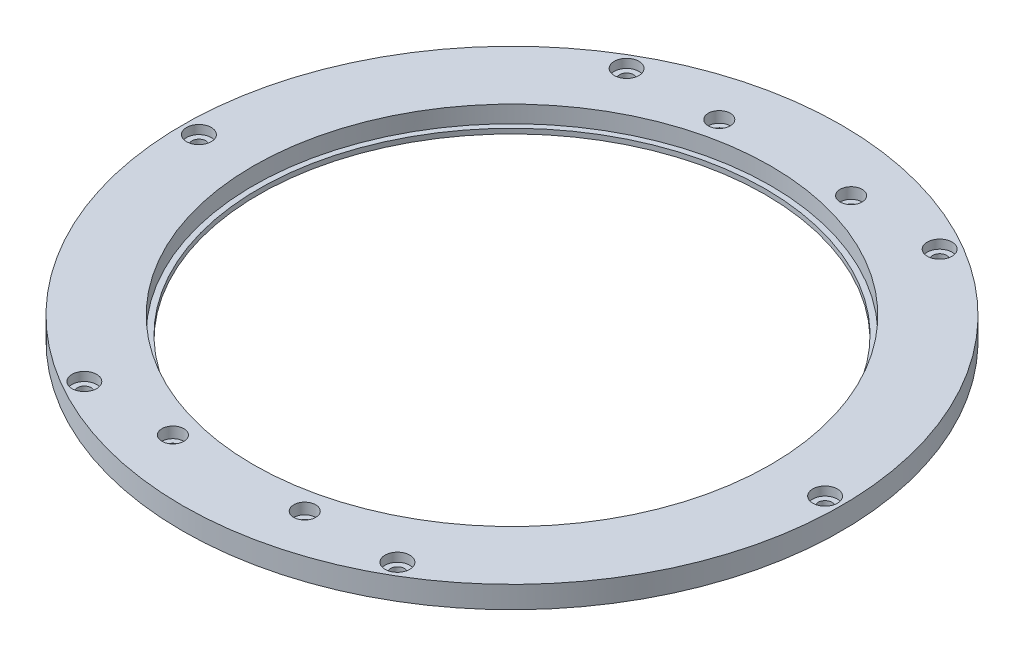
SolidWorks part; units mm, degrees
ref_plane "前视基准面" through (0, 0, 0) normal (0, 0, 1) x (1, 0, 0)
ref_plane "上视基准面" through (0, 0, 0) normal (0, 1, 0) x (1, 0, 0)
ref_plane "右视基准面" through (0, 0, 0) normal (1, 0, 0) x (0, 0, -1)
sketch "草图1" plane through (0, 0, 0) normal (0, 1, 0) x (1, 0, 0)
  circle A0 centre (0, 0) radius 47.1
  circle A1 centre (0, 0) radius 60
  dimension "D1" = 94.2
  dimension "D2" = 120
extrude "凸台-拉伸1" add sketch "草图1" along normal blind 4
sketch "草图2" plane through (0, 0, 0) normal (0, -1, 0) x (1, 0, 0)
  circle A0 centre (0, 0) radius 46.1
  circle A2 centre (0, 0) radius 47.1 construction
  circle A3 centre (0, 0) radius 47.1
  dimension "D1" = 1
extrude "凸台-拉伸2" add sketch "草图2" against normal blind 0.9
sketch "草图3" plane through (0, 0, 0) normal (0, -1, 0) x (1, 0, 0)
  circle A0 centre (-28.5, 49.3634) radius 1.25
  circle A1 centre (-57, 0) radius 1.25
  circle A2 centre (-28.5, -49.3634) radius 1.25
  circle A3 centre (28.5, -49.3634) radius 1.25
  circle A4 centre (57, 0) radius 1.25
  circle A6 centre (28.5, 49.3634) radius 1.25
extrude "切除-拉伸1" cut sketch "草图3" against normal through all
sketch "草图4" plane through (0, 4, 0) normal (0, 1, 0) x (1, 0, 0)
  circle A0 centre (-28.5, 49.3634) radius 2.25
  circle A1 centre (28.5, 49.3634) radius 2.25
  circle A2 centre (57, 0) radius 2.25
  circle A3 centre (28.5, -49.3634) radius 2.25
  circle A4 centre (-28.5, -49.3634) radius 2.25
  circle A5 centre (-57, 0) radius 2.25
  point P3 (-32.6124, -57.451)
  point P4 (0, 0)
  point P15 (0, 0)
  dimension "D1" = 6
extrude "切除-拉伸2" cut sketch "草图4" against normal blind 1.6
sketch "草图5" plane through (0, 0, 0) normal (0, -1, 0) x (1, 0, 0)
  circle A0 centre (-12, -49.7359) radius 1
  circle A1 centre (12, -49.7359) radius 1
  circle A2 centre (-12, 49.7359) radius 1
  circle A3 centre (12, 49.7359) radius 1
extrude "切除-拉伸3" cut sketch "草图5" against normal through all
sketch "草图6" plane through (0, 4, 0) normal (0, 1, 0) x (1, 0, 0)
  circle A0 centre (-12, 49.7359) radius 2
  circle A1 centre (12, 49.7359) radius 2
  circle A2 centre (-12, -49.7359) radius 2
  circle A3 centre (12, -49.7359) radius 2
extrude "切除-拉伸4" cut sketch "草图6" against normal blind 2
